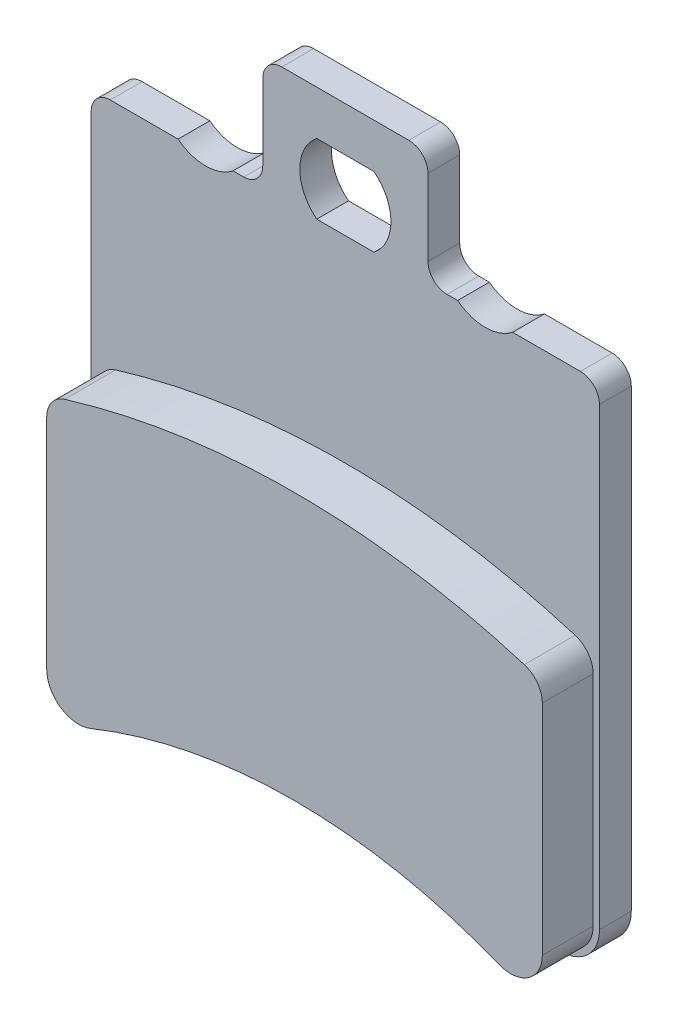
SolidWorks part; units mm, degrees
ref_plane "Plan1" through (0, 0, 0) normal (0, 0, 1) x (1, 0, 0)
ref_plane "Plan2" through (0, 0, 0) normal (0, 1, 0) x (1, 0, 0)
ref_plane "Plan3" through (0, 0, 0) normal (1, 0, 0) x (0, 0, -1)
sketch "Esquisse1" plane through (0, 0, 0) normal (0, 0, 1) x (1, 0, 0)
  line L0 (8, 20) -> (8.8349, 20)
  line L1 (-20, -22) -> (20, -22) construction
  line L2 (-20, -17.2951) -> (-20, 18.5)
  line L3 (-18.5, 20) -> (-13.1651, 20)
  line L4 (20, -17.2951) -> (20, 18.5)
  line L5 (0, 0) -> (0, 39.1984) construction
  line L6 (-6.5, 21.5) -> (-6.5, 27.5)
  line L7 (-5, 29) -> (5, 29)
  line L8 (6.5, 21.5) -> (6.5, 27.5)
  line L9 (-2.25, 25.5) -> (2.25, 25.5)
  line L10 (-2.25, 25.5) -> (-2.25, 20) construction
  line L11 (-2.25, 20) -> (2.25, 20)
  line L12 (2.25, 25.5) -> (2.25, 20) construction
  line L13 (13.1651, 20) -> (18.5, 20)
  line L14 (-8.8349, 20) -> (-8, 20)
  arc A0 (-15.8791, -20.0779) -> (15.8791, -20.0779) centre (0, -59.5) cw
  arc A1 (20, -17.2951) -> (15.8791, -20.0779) centre (17, -17.2951) cw
  arc A2 (-20, -17.2951) -> (-15.8791, -20.0779) centre (-17, -17.2951) ccw
  arc A3 (-2.25, 25.5) -> (-2.25, 20) centre (-0.0849, 22.75) ccw
  arc A4 (2.25, 25.5) -> (2.25, 20) centre (0.0849, 22.75) cw
  arc A5 (8.8349, 20) -> (13.1651, 20) centre (11, 22.75) ccw
  arc A6 (-8.8349, 20) -> (-13.1651, 20) centre (-11, 22.75) cw
  arc A7 (6.5, 21.5) -> (8, 20) centre (8, 21.5) ccw
  arc A8 (-6.5, 21.5) -> (-8, 20) centre (-8, 21.5) cw
  arc A9 (-18.5, 20) -> (-20, 18.5) centre (-18.5, 18.5) ccw
  arc A10 (20, 18.5) -> (18.5, 20) centre (18.5, 18.5) ccw
  arc A11 (-5, 29) -> (-6.5, 27.5) centre (-5, 27.5) ccw
  arc A12 (6.5, 27.5) -> (5, 29) centre (5, 27.5) ccw
  point P9 (0, 29)
  point P10 (0, -22)
  point P13 (0, -17)
  point P23 (0, 25.5)
  point P26 (2.25, 22.75)
  point P37 (6.5, 20)
  point P44 (20, 20)
  point P49 (6.5, 29)
  dimension "D6" = 3
  dimension "D7" = 3
  dimension "D10" = 5.5
  dimension "D12" = 3.5
  dimension "D13" = 3.5
  dimension "D15" = 3.5
  dimension "D16" = 1.5
  dimension "D17" = 1.5
  dimension "D1" = 40
  dimension "D2" = 42
  dimension "D3" = 13
  dimension "D4" = 9
  dimension "D5" = 37
  dimension "D8" = 20
  dimension "D9" = 20
  dimension "D11" = 4.5
  dimension "D14" = 11
extrude "Base-Extrusion" add sketch "Esquisse1" along normal blind 2.5
sketch "Esquisse2" plane through (0, 0, 2.5) normal (0, 0, 1) x (1, 0, 0)
  line L7 (19.5, -17.2951) -> (19.5, -0.1041)
  line L8 (-19.5, -0.1041) -> (-19.5, -17.2951)
  line L9 (20, -17.2951) -> (20, 18.5)
  line L10 (18.5, 20) -> (13.1651, 20)
  line L11 (8.8349, 20) -> (8, 20)
  line L12 (6.5, 21.5) -> (6.5, 27.5)
  line L13 (5, 29) -> (-5, 29)
  line L14 (-6.5, 27.5) -> (-6.5, 21.5)
  line L15 (-8, 20) -> (-8.8349, 20)
  line L16 (-13.1651, 20) -> (-18.5, 20)
  line L17 (-20, 18.5) -> (-20, -17.2951)
  line L18 (20, -17.2951) -> (20, 18.5) construction
  line L19 (18.5, 20) -> (13.1651, 20) construction
  line L20 (8.8349, 20) -> (8, 20) construction
  line L21 (6.5, 21.5) -> (6.5, 27.5) construction
  line L22 (5, 29) -> (-5, 29) construction
  line L23 (-6.5, 27.5) -> (-6.5, 21.5) construction
  line L24 (-8, 20) -> (-8.8349, 20) construction
  line L25 (-13.1651, 20) -> (-18.5, 20) construction
  line L26 (-20, 18.5) -> (-20, -17.2951) construction
  arc A0 (-19.5, -0.1041) -> (-18.0823, 1.8092) centre (-17.5, -0.1041) cw
  arc A1 (19.5, -0.1041) -> (18.0823, 1.8092) centre (17.5, -0.1041) ccw
  arc A7 (16.0659, -19.6141) -> (19.5, -17.2951) centre (17, -17.2951) ccw
  arc A8 (16.0659, -19.6141) -> (-16.0659, -19.6141) centre (0, -59.5) ccw
  arc A9 (-19.5, -17.2951) -> (-16.0659, -19.6141) centre (-17, -17.2951) ccw
  arc A11 (-20, -17.2951) -> (-15.8791, -20.0779) centre (-17, -17.2951) ccw
  arc A12 (15.8791, -20.0779) -> (-15.8791, -20.0779) centre (0, -59.5) ccw
  arc A13 (15.8791, -20.0779) -> (20, -17.2951) centre (17, -17.2951) ccw
  arc A14 (20, 18.5) -> (18.5, 20) centre (18.5, 18.5) ccw
  arc A15 (8.8349, 20) -> (13.1651, 20) centre (11, 22.75) ccw
  arc A16 (6.5, 21.5) -> (8, 20) centre (8, 21.5) ccw
  arc A17 (6.5, 27.5) -> (5, 29) centre (5, 27.5) ccw
  arc A18 (-5, 29) -> (-6.5, 27.5) centre (-5, 27.5) ccw
  arc A19 (-8, 20) -> (-6.5, 21.5) centre (-8, 21.5) ccw
  arc A20 (-13.1651, 20) -> (-8.8349, 20) centre (-11, 22.75) ccw
  arc A21 (-18.5, 20) -> (-20, 18.5) centre (-18.5, 18.5) ccw
  arc A22 (-20, -17.2951) -> (-15.8791, -20.0779) centre (-17, -17.2951) ccw construction
  arc A23 (15.8791, -20.0779) -> (-15.8791, -20.0779) centre (0, -59.5) ccw construction
  arc A24 (15.8791, -20.0779) -> (20, -17.2951) centre (17, -17.2951) ccw construction
  arc A25 (20, 18.5) -> (18.5, 20) centre (18.5, 18.5) ccw construction
  arc A26 (8.8349, 20) -> (13.1651, 20) centre (11, 22.75) ccw construction
  arc A27 (6.5, 21.5) -> (8, 20) centre (8, 21.5) ccw construction
  arc A28 (6.5, 27.5) -> (5, 29) centre (5, 27.5) ccw construction
  arc A29 (-5, 29) -> (-6.5, 27.5) centre (-5, 27.5) ccw construction
  arc A30 (-8, 20) -> (-6.5, 21.5) centre (-8, 21.5) ccw construction
  arc A31 (-13.1651, 20) -> (-8.8349, 20) centre (-11, 22.75) ccw construction
  arc A32 (-18.5, 20) -> (-20, 18.5) centre (-18.5, 18.5) ccw construction
  arc A33 (-18.0823, 1.8092) -> (18.0823, 1.8092) centre (0, -57.6032) cw
  point P54 (0, -16.5)
  point P56 (0, 4.5)
  point P57 (16.0659, 2.3859)
  dimension "D3" = 21
  dimension "D5" = 2
  dimension "D4" = 22
  dimension "D1" = 0
  dimension "D2" = 0.5
extrude "Boss.-Extru.1" add sketch "Esquisse2" along normal blind 4
